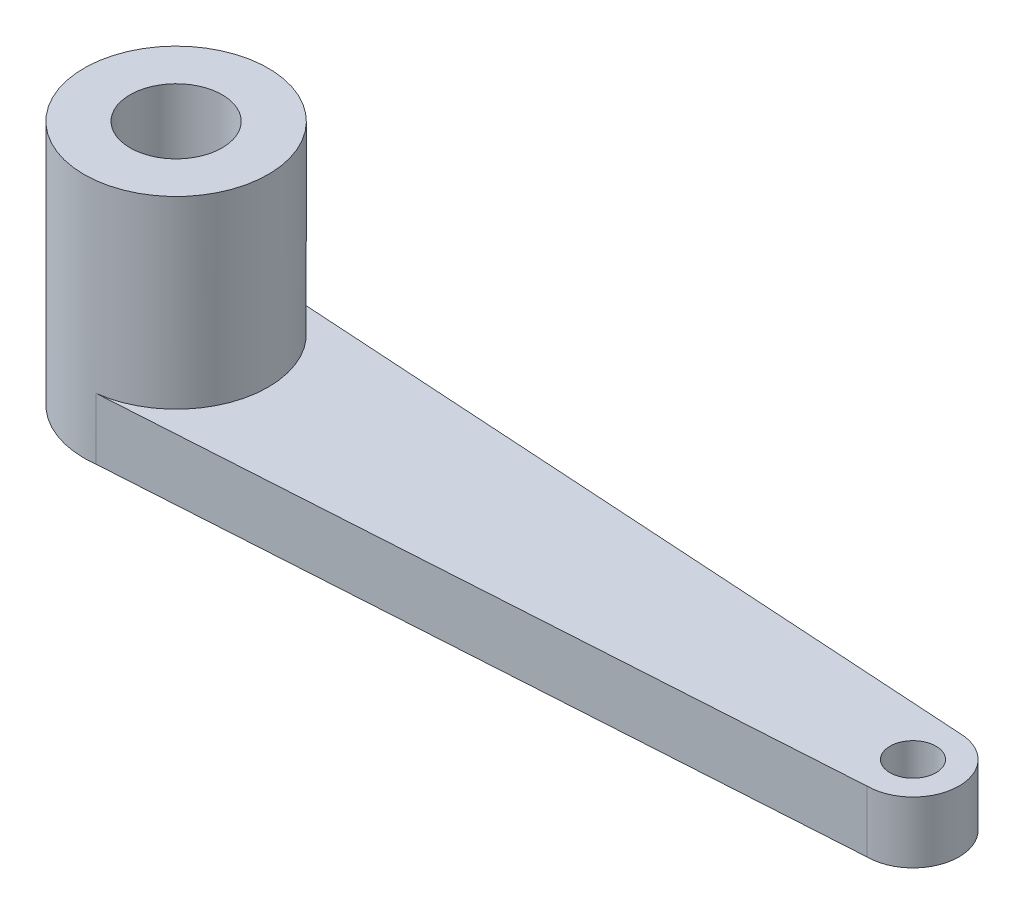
SolidWorks part; units mm, degrees
ref_plane "Front Plane" through (0, 0, 0) normal (0, 0, 1) x (1, 0, 0)
ref_plane "Top Plane" through (0, 0, 0) normal (0, 1, 0) x (1, 0, 0)
ref_plane "Right Plane" through (0, 0, 0) normal (1, 0, 0) x (0, 0, -1)
sketch "Sketch1" plane through (0, 0, 0) normal (0, 1, 0) x (1, 0, 0)
  circle A0 centre (0, 0) radius 3.175
  dimension "D1" = 6.35
extrude "Boss-Extrude1" add sketch "Sketch1" along normal blind 8.4667
sketch "Sketch2" plane through (0, 0, 0) normal (0, -1, 0) x (-1, 0, 0)
  line L0 (0, 3.175) -> (-25.4, 1.5875)
  line L1 (0, -3.175) -> (-25.4, -1.5875)
  line L2 (0, 3.175) -> (0, -3.175)
  arc A0 (-25.4, 1.5875) -> (-25.4, -1.5875) centre (-25.4, 0) ccw
  circle A1 centre (0, 0) radius 3.175 construction
  dimension "D1" = 3.175
  dimension "D2" = 25.4
extrude "Boss-Extrude2" add sketch "Sketch2" against normal blind 2.1167
sketch "Sketch3" plane through (0, 8.4667, 0) normal (0, 1, 0) x (1, 0, 0)
  circle A0 centre (0, 0) radius 1.5875
  dimension "D1" = 3.175
extrude "Cut-Extrude2" cut sketch "Sketch3" against normal through all
sketch "Sketch4" plane through (0, 0, 0) normal (0, -1, 0) x (-1, 0, 0)
  circle A0 centre (-25.4, 0) radius 0.7937
  dimension "D2" = 1.5875
  dimension "D1" = 25.4
extrude "Cut-Extrude3" cut sketch "Sketch4" against normal through all
